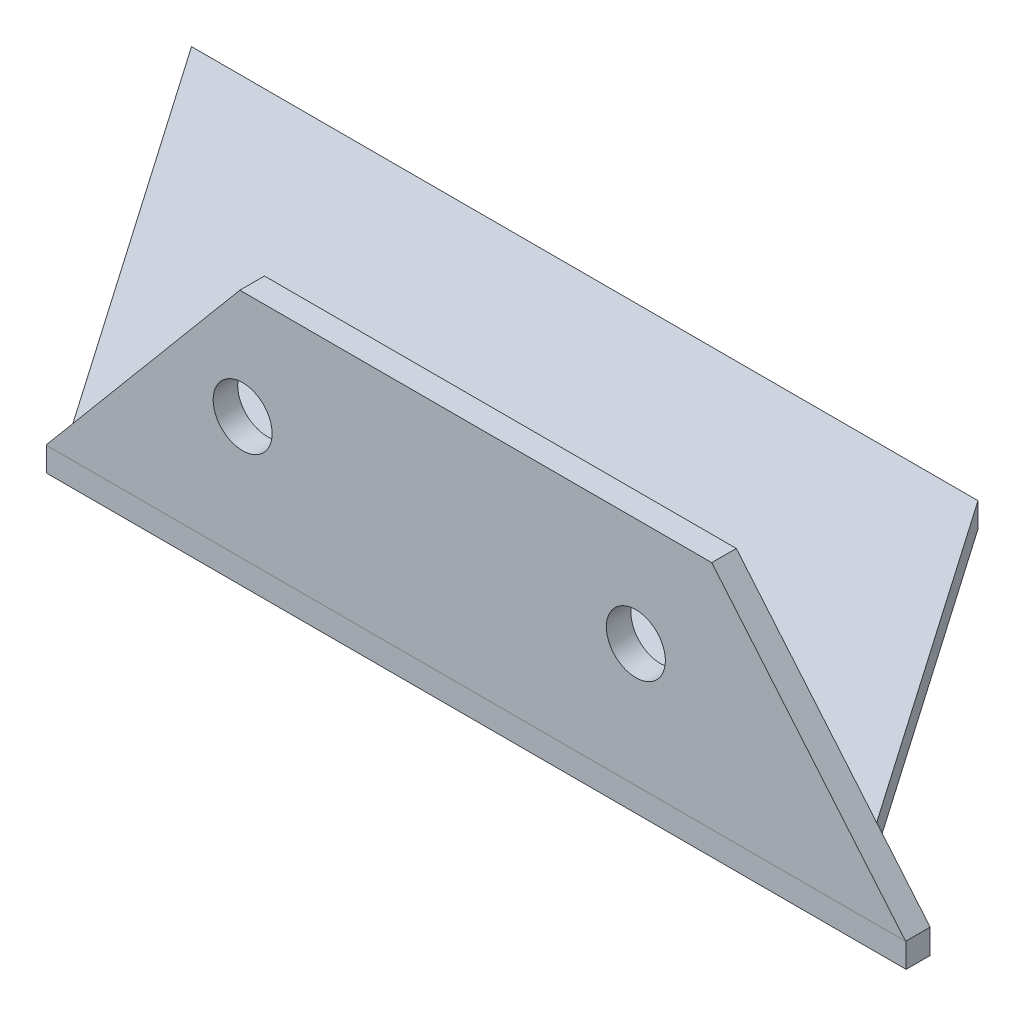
SolidWorks part; units mm, degrees
ref_plane "Front Plane" through (0, 0, 0) normal (0, 0, 1) x (1, 0, 0)
ref_plane "Top Plane" through (0, 0, 0) normal (0, 1, 0) x (1, 0, 0)
ref_plane "Right Plane" through (0, 0, 0) normal (1, 0, 0) x (0, 0, -1)
sketch "Sketch1" plane through (0, 0, 0) normal (0, 1, 0) x (1, 0, 0)
  line L0 (0, 0) -> (42.6263, 50.8)
  line L1 (42.6263, 50.8) -> (144.2263, 50.8)
  line L2 (144.2263, 50.8) -> (101.6, 0)
  line L3 (0, 0) -> (101.6, 0)
  dimension "D1" = 101.6
  dimension "D2" = 50
  dimension "D3" = 50.8
extrude "Boss-Extrude1" add sketch "Sketch1" along normal blind 3.175
ref_plane "Plane1" through (0, 0, -50.8) normal (0, 0, -1) x (-1, 0, 0)
sketch "Sketch3" plane through (0, 0, -50.8) normal (0, 0, -1) x (-1, 0, 0)
  line L0 (-42.6263, 3.175) -> (-67.6692, 33.02)
  line L1 (-67.6692, 33.02) -> (-128.6292, 33.02)
  line L2 (-128.6292, 33.02) -> (-153.6721, 3.175)
  line L3 (-144.2263, 3.175) -> (-42.6263, 3.175) construction
  line L4 (-153.6721, 3.175) -> (-153.6721, 0)
  line L5 (-153.6721, 0) -> (-42.6263, 0)
  line L6 (-42.6263, 0) -> (-42.6263, 3.175)
  dimension "D1" = 60.96
  dimension "D2" = 50
  dimension "D3" = 33.02
extrude "mt flange" add sketch "Sketch3" along normal blind 3.175
sketch "Sketch4" plane through (0, 0, -53.975) normal (0, 0, -1) x (-1, 0, 0)
  line L0 (-42.6263, 0) -> (-42.6263, 3.175) construction
  line L1 (-153.6721, 0) -> (-42.6263, 0) construction
  circle A0 centre (-68.0263, 19.05) radius 3.81
  circle A1 centre (-118.8263, 19.05) radius 3.81
  point P4 (-42.6263, 1.5875)
  dimension "D4" = 7.62
  dimension "D1" = 25.4
  dimension "D2" = 50.8
  dimension "D3" = 19.05
extrude "holes" cut sketch "Sketch4" against normal through all
sketch "Sketch5" plane through (0, 0, 0) normal (0, 1, 0) x (1, 0, 0)
  line L0 (42.6263, 53.975) -> (7.4507, 104.775)
  line L1 (42.6263, 53.975) -> (144.2263, 53.975)
  line L2 (153.6721, 53.975) -> (42.6263, 53.975) construction
  line L3 (144.2263, 53.975) -> (109.0507, 104.775)
  line L4 (109.0507, 104.775) -> (7.4507, 104.775)
  dimension "D1" = 55.3
  dimension "D2" = 50.8
  dimension "D3" = 101.6
extrude "Boss-Extrude2" add sketch "Sketch5" along normal blind 3.175
sketch "Sketch7" plane through (0, 3.175, 0) normal (0, 1, 0) x (1, 0, 0)
  line L1 (-6.1015, 0) -> (158.8134, 0)
  line L2 (-6.1015, 0) -> (-6.1015, 50.8677)
  line L3 (-6.1015, 50.8677) -> (158.8134, 50.8677)
  line L4 (158.8134, 0) -> (158.8134, 50.8677)
extrude "orig side" cut sketch "Sketch7" against normal through all
